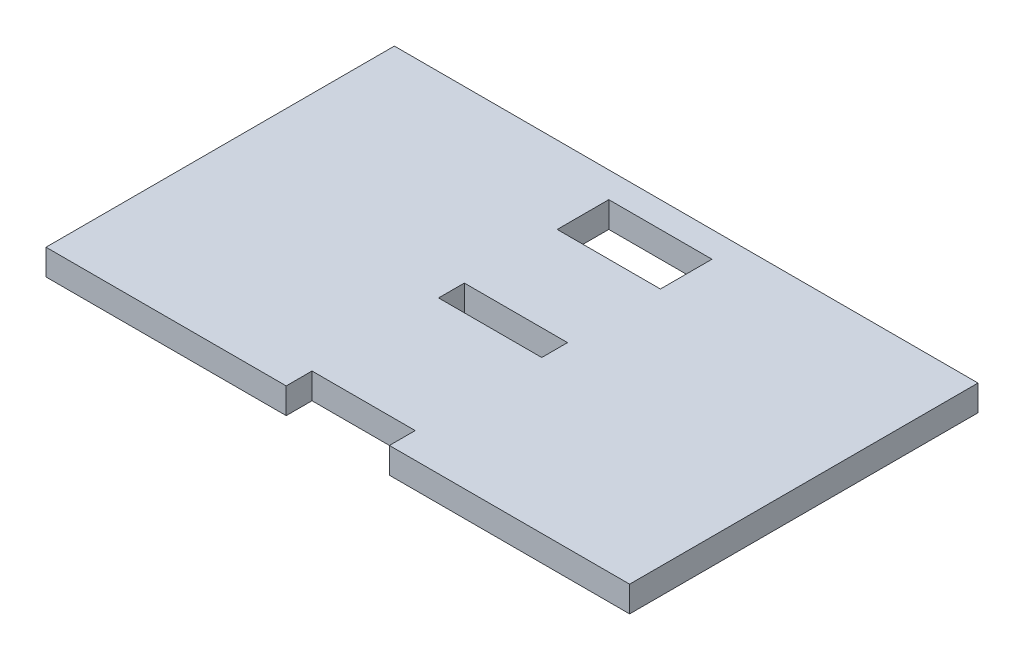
SolidWorks part; units mm, degrees
ref_plane "Front Plane" through (0, 0, 0) normal (0, 0, 1) x (1, 0, 0)
ref_plane "Top Plane" through (0, 0, 0) normal (0, 1, 0) x (1, 0, 0)
ref_plane "Right Plane" through (0, 0, 0) normal (1, 0, 0) x (0, 0, -1)
sketch "Sketch1" plane through (0, 0, 0) normal (0, 1, 0) x (1, 0, 0)
  line L0 (46.5594, 104.8614) -> (0, 104.8614) construction
  line L1 (0, 0) -> (113.1189, 0) construction
  line L2 (0, 0) -> (0, 114.8614) construction
  line L3 (0, 114.8614) -> (113.1189, 114.8614)
  line L4 (113.1189, 0) -> (113.1189, 114.8614) construction
  line L5 (46.5594, 109.8614) -> (66.5594, 109.8614)
  line L6 (46.5594, 109.8614) -> (46.5594, 99.8614)
  line L7 (46.5594, 99.8614) -> (66.5594, 99.8614)
  line L8 (66.5594, 109.8614) -> (66.5594, 99.8614)
  line L9 (46.5594, 5) -> (66.5594, 5) construction
  line L10 (46.5594, 5) -> (46.5594, 10) construction
  line L11 (46.5594, 10) -> (66.5594, 10) construction
  line L12 (66.5594, 5) -> (66.5594, 10) construction
  line L13 (46.5594, 47.338) -> (66.5594, 47.338) construction
  line L14 (46.5594, 47.338) -> (46.5594, 52.338)
  line L15 (46.5594, 52.338) -> (66.5594, 52.338)
  line L16 (66.5594, 47.338) -> (66.5594, 52.338)
  line L17 (46.5594, 76.8642) -> (66.5594, 76.8642)
  line L18 (46.5594, 76.8642) -> (46.5594, 81.8642)
  line L19 (46.5594, 81.8642) -> (66.5594, 81.8642)
  line L20 (66.5594, 76.8642) -> (66.5594, 81.8642)
  line L21 (66.5594, 104.8614) -> (113.1189, 104.8614) construction
  line L22 (0, 114.8614) -> (0, 47.338)
  line L23 (0, 47.338) -> (46.5594, 47.338)
  line L24 (66.5594, 47.338) -> (113.1189, 47.338)
  line L25 (113.1189, 47.338) -> (113.1189, 114.8614)
  point P25 (56.5594, 5)
  dimension "D1" = 114.8614
  dimension "D2" = 113.1189
  dimension "D3" = 20
  dimension "D4" = 5
  dimension "D5" = 10
  dimension "D6" = 5
  dimension "D7" = 5
  dimension "D8" = 37.338
  dimension "D9" = 24.5262
extrude "Boss-Extrude1" add sketch "Sketch1" along normal blind 5
